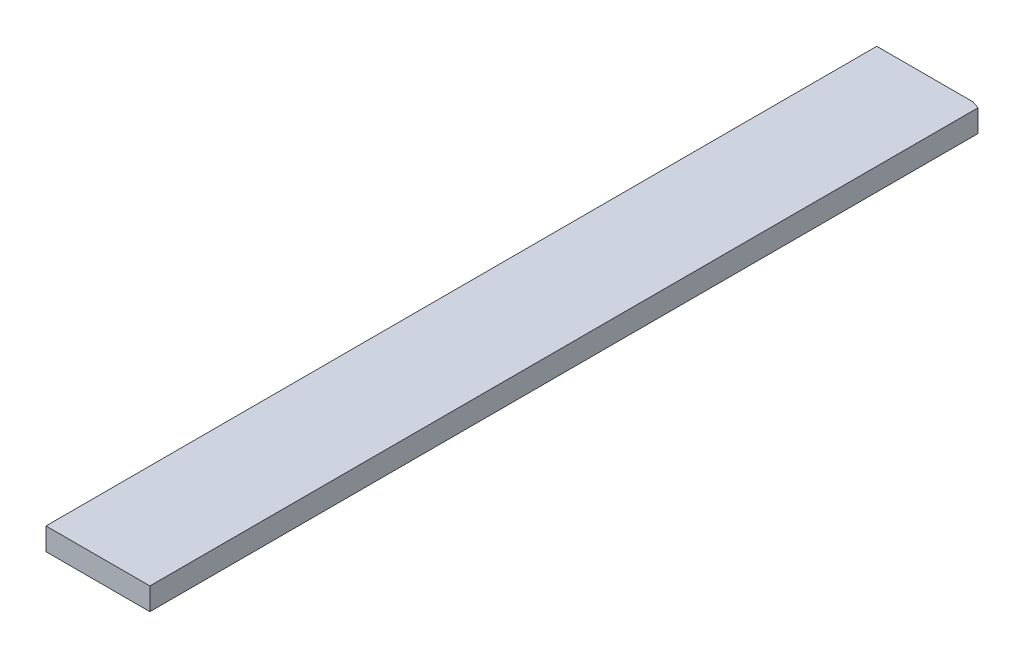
SolidWorks part; units mm, degrees
ref_plane "Front Plane" through (0, 0, 0) normal (0, 0, 1) x (1, 0, 0)
ref_plane "Top Plane" through (0, 0, 0) normal (0, 1, 0) x (1, 0, 0)
ref_plane "Right Plane" through (0, 0, 0) normal (1, 0, 0) x (0, 0, -1)
sketch "Sketch1" plane through (0, 0, 0) normal (0, 1, 0) x (1, 0, 0)
  line L1 (-295.275, 2587.6707) -> (295.275, 2587.6707)
  line L2 (-295.275, 2587.6707) -> (-295.275, -2587.6707)
  line L3 (-295.275, -2587.6707) -> (295.275, -2587.6707)
  line L4 (295.275, 2587.6707) -> (295.275, -2587.6707)
  line L5 (-295.275, 2587.6707) -> (295.275, -2587.6707) construction
  line L6 (-295.275, -2587.6707) -> (295.275, 2587.6707) construction
  point P0 (0, 0)
  dimension "D1" = 590.55
  dimension "D2" = 5175.3414
extrude "Boss-Extrude1" add sketch "Sketch1" along normal blind 127
sketch "Sketch2" plane through (0, 0, 0) normal (0, -1, 0) x (1, 0, 0)
  line L0 (-295.275, 2587.6707) -> (-295.275, 2134.9325)
  line L1 (-295.275, -2587.6707) -> (-295.275, 2587.6707) construction
  line L2 (2016.7002, 2134.9325) -> (-358.1998, 2134.9325) construction
  line L3 (-295.275, 2134.9325) -> (295.275, 2134.9325)
  line L4 (295.275, 2587.6707) -> (295.275, -2587.6707) construction
  line L5 (295.275, 2134.9325) -> (295.275, 2587.6707)
  line L6 (295.275, 2587.6707) -> (-295.275, 2587.6707)
  line L7 (295.275, -2587.6707) -> (295.275, -2572.6018)
  line L8 (251.5116, -2587.6707) -> (2016.7002, -1979.8675) construction
  line L9 (295.275, -2572.6018) -> (251.5116, -2587.6707)
  line L10 (295.275, -2587.6707) -> (-295.275, -2587.6707) construction
  line L11 (251.5116, -2587.6707) -> (295.275, -2587.6707)
extrude "Cut-Extrude1" cut sketch "Sketch2" against normal through all
